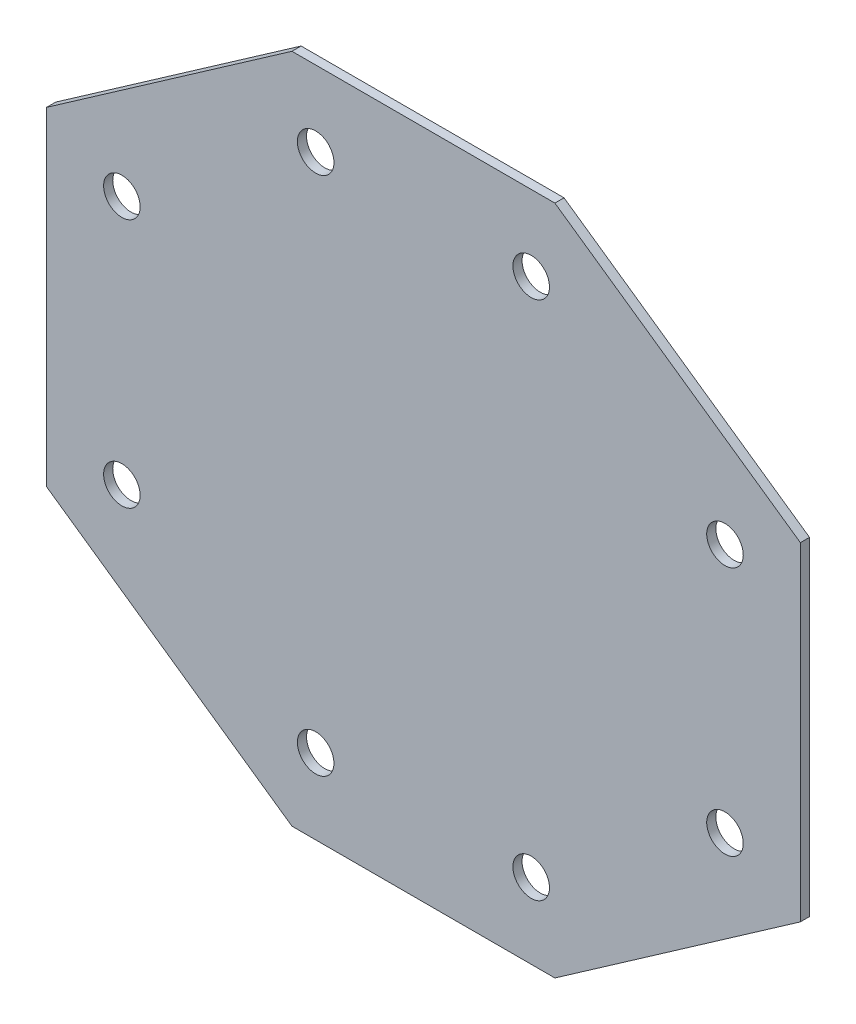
SolidWorks part; units mm, degrees
ref_plane "Front Plane" through (0, 0, 0) normal (1, 0, 0) x (0, 1, 0)
ref_plane "Top Plane" through (0, 0, 0) normal (0, 0, 1) x (0, 1, 0)
ref_plane "Right Plane" through (0, 0, 0) normal (0, 1, 0) x (-1, 0, 0)
sketch "sk W14x730" plane through (0, 0, 0) normal (0, 0, 1) x (0, 1, 0)
  point P0 (0, -284.734)
  point P1 (-38.989, 0)
  line B0 (-227.203, -284.734) -> (-227.203, -160.02)
  line B1 (-227.203, -160.02) -> (-54.229, -160.02)
  line B2 (-38.989, -144.78) -> (-38.989, 144.78)
  line B3 (-54.229, 160.02) -> (-227.203, 160.02)
  line B4 (-227.203, 160.02) -> (-227.203, 284.734)
  line B5 (-227.203, 284.734) -> (227.203, 284.734)
  line B6 (227.203, 284.734) -> (227.203, 160.02)
  line B7 (227.203, 160.02) -> (54.229, 160.02)
  line B8 (38.989, 144.78) -> (38.989, -144.78)
  line B9 (54.229, -160.02) -> (227.203, -160.02)
  line B10 (227.203, -160.02) -> (227.203, -284.734)
  line B11 (227.203, -284.734) -> (-227.203, -284.734)
  arc B12 (-54.229, -160.02) -> (-38.989, -144.78) centre (-54.229, -144.78) ccw
  arc B13 (-38.989, 144.78) -> (-54.229, 160.02) centre (-54.229, 144.78) ccw
  arc B14 (54.229, 160.02) -> (38.989, 144.78) centre (54.229, 144.78) ccw
  arc B15 (38.989, -144.78) -> (54.229, -160.02) centre (54.229, -144.78) ccw
sketch_block_instance "W14x730-113"
sketch_block "W14x730" parameters "D4"=15.24, "D1"=454.406, "D2"=569.468, "D3"=77.978, "D5"=124.714
sketch_block_instance "W14x730-232"
sketch_block_instance "W14x730-233"
sketch_block_instance "W14x730-234"
sketch_block_instance "W14x730-276"
sketch_block_instance "W14x730-277"
sketch_block_instance "W14x730-278"
sketch_block_instance "W14x730-279"
sketch_block_instance "W14x730-280"
sketch_block_instance "W14x730-281"
sketch_block_instance "W14x730-282"
sketch_block_instance "W14x730-283"
sketch_block_instance "W14x730-284"
sketch_block_instance "W14x730-285"
sketch_block_instance "W14x730-286"
sketch_block_instance "W14x730-287"
sketch_block_instance "W14x730-288"
sketch_block_instance "W14x730-289"
sketch_block_instance "W14x730-321"
sketch_block_instance "W14x730-322"
sketch_block_instance "W14x730-323"
sketch_block_instance "W14x730-324"
sketch_block_instance "W14x730-325"
sketch_block_instance "W14x730-326"
sketch_block_instance "W14x730-327"
sketch_block_instance "W14x730-328"
sketch_block_instance "W14x730-329"
sketch_block_instance "W14x730-330"
sketch_block_instance "W14x730-331"
sketch_block_instance "W14x730-332"
sketch_block_instance "W14x730-333"
sketch_block_instance "W14x730-334"
sketch_block_instance "W14x730-335"
sketch_block_instance "W14x730-336"
sketch_block_instance "W14x730-337"
sketch_block_instance "W14x730-338"
sketch_block_instance "W14x730-339"
sketch_block_instance "W14x730-340"
sketch_block_instance "W14x730-341"
sketch_block_instance "W14x730-365"
sketch_block_instance "W14x730-366"
sketch_block_instance "W14x730-367"
sketch_block_instance "W14x730-368"
sketch_block_instance "W14x730-369"
sketch_block_instance "W14x730-370"
sketch_block_instance "W14x730-371"
sketch_block_instance "W14x730-372"
sketch_block_instance "W14x730-373"
sketch_block_instance "W14x730-374"
sketch_block_instance "W14x730-375"
sketch_block_instance "W14x730-376"
sketch_block_instance "W14x730-377"
sketch_block_instance "W14x730-378"
sketch_block_instance "W14x730-379"
sketch_block_instance "W14x730-380"
sketch_block_instance "W14x730-381"
sketch_block_instance "W14x730-382"
sketch_block_instance "W14x730-383"
sketch_block_instance "W14x730-384"
sketch_block_instance "W14x730-385"
sketch_block_instance "W14x730-386"
sketch_block_instance "W14x730-387"
sketch_block_instance "W14x730-388"
sketch_block_instance "W14x730-389"
sketch_block_instance "W14x730-390"
sketch_block_instance "W14x730-391"
sketch_block_instance "W14x730-410"
sketch_block_instance "W14x730-411"
sketch_block_instance "W14x730-412"
sketch_block_instance "W14x730-413"
sketch_block_instance "W14x730-414"
sketch_block_instance "W14x730-415"
sketch_block_instance "W14x730-416"
sketch_block_instance "W14x730-417"
sketch_block_instance "W14x730-418"
sketch_block_instance "W14x730-419"
sketch_block_instance "W14x730-420"
sketch_block_instance "W14x730-421"
sketch_block_instance "W14x730-422"
sketch_block_instance "W14x730-423"
sketch_block_instance "W14x730-424"
sketch_block_instance "W14x730-425"
sketch_block_instance "W14x730-426"
sketch_block_instance "W14x730-427"
sketch_block_instance "W14x730-428"
sketch_block_instance "W14x730-429"
sketch_block_instance "W14x730-430"
sketch_block_instance "W14x730-431"
sketch_block_instance "W14x730-432"
sketch_block_instance "W14x730-433"
sketch_block_instance "W14x730-434"
sketch_block_instance "W14x730-435"
sketch_block_instance "W14x730-436"
sketch_block_instance "W14x730-437"
sketch_block_instance "W14x730-438"
sketch_block_instance "W14x730-439"
sketch_block_instance "W14x730-440"
sketch_block_instance "W14x730-443"
sketch_block_instance "W14x730-454"
sketch_block_instance "W14x730-455"
sketch_block_instance "W14x730-456"
sketch_block_instance "W14x730-457"
sketch_block_instance "W14x730-458"
sketch_block_instance "W14x730-459"
sketch_block_instance "W14x730-460"
sketch_block_instance "W14x730-461"
sketch_block_instance "W14x730-462"
sketch_block_instance "W14x730-463"
sketch_block_instance "W14x730-464"
sketch_block_instance "W14x730-465"
sketch_block_instance "W14x730-466"
sketch_block_instance "W14x730-467"
sketch_block_instance "W14x730-468"
sketch_block_instance "W14x730-469"
sketch_block_instance "W14x730-470"
sketch_block_instance "W14x730-471"
sketch_block_instance "W14x730-472"
sketch_block_instance "W14x730-473"
sketch_block_instance "W14x730-474"
sketch_block_instance "W14x730-475"
sketch_block_instance "W14x730-476"
sketch_block_instance "W14x730-477"
sketch_block_instance "W14x730-478"
sketch_block_instance "W14x730-479"
sketch_block_instance "W14x730-480"
sketch_block_instance "W14x730-481"
sketch_block_instance "W14x730-482"
sketch_block_instance "W14x730-483"
sketch_block_instance "W14x730-484"
sketch_block_instance "W14x730-485"
sketch_block_instance "W14x730-486"
sketch_block_instance "W14x730-487"
sketch_block_instance "W14x730-488"
sketch_block_instance "W14x730-489"
sketch_block_instance "W14x730-490" parameters "D1"=817.9177, "D2"=1027.7361, "D3"=0.4058, "D4"=24.0009, "D5"=0.4058, "D6"=533.4, "D7"=27.3509, "D8"=8374.3758, "D9"=3499.6788, "D10"=18059.4
sketch "sk 4\" hex nut Pattern" plane through (0, 0, 0) normal (0, 0, 1) x (0, 1, 0)
  line L7 (419.0803, -173.5887) -> (419.0803, 173.5887)
  line L8 (419.0803, 173.5887) -> (173.5887, 419.0803)
  line L9 (173.5887, 419.0803) -> (-173.5887, 419.0803)
  line L10 (-173.5887, 419.0803) -> (-419.0803, 173.5887)
  line L11 (-419.0803, 173.5887) -> (-419.0803, -173.5887)
  line L12 (-419.0803, -173.5887) -> (-173.5887, -419.0803)
  line L13 (-173.5887, -419.0803) -> (173.5887, -419.0803)
  line L14 (173.5887, -419.0803) -> (419.0803, -173.5887)
  line L29 (54.229, -125.02) -> (262.203, -125.02)
  line L30 (262.203, -125.02) -> (262.203, -319.734)
  line L31 (-262.203, -125.02) -> (-54.229, -125.02)
  line L32 (-262.203, -319.734) -> (-262.203, -125.02)
  line L33 (262.203, -319.734) -> (-262.203, -319.734)
  line L34 (54.229, -125.02) -> (262.203, -125.02)
  line L35 (262.203, -125.02) -> (262.203, -319.734)
  line L36 (-262.203, -125.02) -> (-54.229, -125.02)
  line L37 (-262.203, -319.734) -> (-262.203, -125.02)
  line L38 (262.203, -319.734) -> (-262.203, -319.734)
  line L39 (-419.0803, 173.5887) -> (419.0803, -173.5887)
  line L40 (419.0803, 173.5887) -> (-419.0803, -173.5887)
  line L42 (-466.3243, 523.8553) -> (466.3243, 523.8553)
  line L43 (-466.3243, 523.8553) -> (-466.3243, -523.8553)
  line L44 (262.203, 125.02) -> (54.229, 125.02)
  line L45 (262.203, 319.734) -> (262.203, 125.02)
  line L46 (-262.203, 319.734) -> (262.203, 319.734)
  line L47 (-262.203, 125.02) -> (-262.203, 319.734)
  line L48 (-54.229, 125.02) -> (-262.203, 125.02)
  line L49 (262.203, 125.02) -> (54.229, 125.02)
  line L50 (262.203, 319.734) -> (262.203, 125.02)
  line L51 (-262.203, 319.734) -> (262.203, 319.734)
  line L52 (-262.203, 125.02) -> (-262.203, 319.734)
  line L53 (-54.229, 125.02) -> (-262.203, 125.02)
  line L54 (-466.3243, -523.8553) -> (466.3243, -523.8553)
  line L55 (466.3243, 523.8553) -> (466.3243, -523.8553)
  circle A0 centre (0, 0) radius 419.0803 construction
  line B0 (-128.6781, -496.8678) -> (-83.7675, -419.0803)
  circle B1 centre (-173.5887, -419.0803) radius 77.7875 construction
  circle B2 centre (-173.5887, -419.0803) radius 50.8
  circle B3 centre (-173.5887, -419.0803) radius 89.8213
  circle B4 centre (-173.5887, -419.0803) radius 99.3463
  line B5 (-83.7675, 419.0803) -> (-128.6781, 496.8678)
  line B6 (-128.6781, 496.8678) -> (-218.4994, 496.8678)
  line B7 (-218.4994, 496.8678) -> (-263.41, 419.0803)
  line B8 (-263.41, 419.0803) -> (-218.4994, 341.2928)
  line B9 (-218.4994, 341.2928) -> (-128.6781, 341.2928)
  circle B10 centre (-173.5887, 419.0803) radius 77.7875 construction
  circle B11 centre (-173.5887, 419.0803) radius 50.8
  circle B12 centre (-173.5887, 419.0803) radius 89.8213
  circle B13 centre (-173.5887, 419.0803) radius 99.3463
  line B14 (263.41, 419.0803) -> (218.4994, 496.8678)
  line B15 (218.4994, 496.8678) -> (128.6781, 496.8678)
  line B16 (128.6781, 496.8678) -> (83.7675, 419.0803)
  line B17 (128.6781, 341.2928) -> (218.4994, 341.2928)
  line B18 (218.4994, 341.2928) -> (263.41, 419.0803)
  circle B19 centre (173.5887, 419.0803) radius 50.8
  circle B20 centre (173.5887, 419.0803) radius 89.8213
  circle B21 centre (173.5887, 419.0803) radius 99.3463
  line B22 (263.41, -419.0803) -> (218.4994, -341.2928)
  line B23 (218.4994, -341.2928) -> (128.6781, -341.2928)
  line B24 (83.7675, -419.0803) -> (128.6781, -496.8678)
  line B25 (128.6781, -496.8678) -> (218.4994, -496.8678)
  line B26 (218.4994, -496.8678) -> (263.41, -419.0803)
  circle B27 centre (173.5887, -419.0803) radius 77.7875 construction
  circle B28 centre (173.5887, -419.0803) radius 50.8
  circle B29 centre (173.5887, -419.0803) radius 89.8213
  circle B30 centre (173.5887, -419.0803) radius 99.3463
  line B31 (-271.728, 149.7586) -> (-316.6386, 227.5461)
  line B32 (-316.6386, 227.5461) -> (-406.4599, 227.5461)
  line B33 (-406.4599, 227.5461) -> (-451.3705, 149.7586)
  line B34 (-451.3705, 149.7586) -> (-406.4599, 71.9711)
  line B35 (-406.4599, 71.9711) -> (-316.6386, 71.9711)
  circle B36 centre (-361.5493, 149.7586) radius 77.7875 construction
  circle B37 centre (-361.5493, 149.7586) radius 50.8
  circle B38 centre (-361.5493, 149.7586) radius 89.8213
  circle B39 centre (-361.5493, 149.7586) radius 99.3463
  line B40 (-271.728, -149.7586) -> (-316.6386, -71.9711)
  line B41 (-316.6386, -71.9711) -> (-406.4599, -71.9711)
  line B42 (-406.4599, -71.9711) -> (-451.3705, -149.7586)
  line B43 (-451.3705, -149.7586) -> (-406.4599, -227.5461)
  line B44 (-406.4599, -227.5461) -> (-316.6386, -227.5461)
  line B45 (-316.6386, -227.5461) -> (-271.728, -149.7586)
  circle B46 centre (-361.5493, -149.7586) radius 77.7875 construction
  circle B47 centre (-361.5493, -149.7586) radius 50.8
  circle B48 centre (-361.5493, -149.7586) radius 89.8213
  circle B49 centre (-361.5493, -149.7586) radius 99.3463
  line B50 (451.3705, 149.7586) -> (406.4599, 227.5461)
  line B51 (406.4599, 227.5461) -> (316.6386, 227.5461)
  line B52 (316.6386, 227.5461) -> (271.728, 149.7586)
  line B53 (316.6386, 71.9711) -> (406.4599, 71.9711)
  circle B54 centre (361.5493, 149.7586) radius 77.7875 construction
  circle B55 centre (361.5493, 149.7586) radius 50.8
  circle B56 centre (361.5493, 149.7586) radius 89.8213
  circle B57 centre (361.5493, 149.7586) radius 99.3463
  line B58 (316.6386, -71.9711) -> (271.728, -149.7586)
  line B59 (406.4599, -227.5461) -> (451.3705, -149.7586)
  circle B60 centre (361.5493, -149.7586) radius 77.7875 construction
  circle B61 centre (361.5493, -149.7586) radius 50.8
  circle B62 centre (361.5493, -149.7586) radius 89.8213
  circle B63 centre (361.5493, -149.7586) radius 99.3463
sketch_block_instance "4\" hex nut-1"
sketch_block "4\" hex nut" parameters "D1"=155.575, "D2"=101.6, "D3"=9.525
sketch_block_instance "4\" hex nut-2"
sketch_block_instance "4\" hex nut-3"
sketch_block_instance "4\" hex nut-4"
sketch_block_instance "4\" hex nut-5"
sketch_block_instance "4\" hex nut-6"
sketch_block_instance "4\" hex nut-7"
sketch_block_instance "4\" hex nut-8" parameters "D1"=129.9071, "D2"=77.383, "D3"=138.8929, "D4"=187.7059, "D5"=195.0068, "D6"=231.3326
sketch "Sketch3" plane through (0, 0, 0) normal (0, 0, 1) x (0, 1, 0)
  line L0 (-466.3243, 523.8553) -> (466.3243, 523.8553) construction
  line L1 (466.3243, 523.8553) -> (466.3243, -523.8553) construction
  line L2 (-466.3243, -523.8553) -> (466.3243, -523.8553) construction
  line L3 (-466.3243, 523.8553) -> (-466.3243, -523.8553) construction
  line L4 (228.2342, 523.8553) -> (466.3243, 182.7049)
  line L5 (466.3243, 182.7049) -> (466.3243, -182.7049)
  line L6 (466.3243, -182.7049) -> (228.2342, -523.8553)
  line L7 (228.2342, -523.8553) -> (-228.2342, -523.8553)
  line L8 (-228.2342, -523.8553) -> (-466.3243, -182.7049)
  line L9 (-466.3243, -182.7049) -> (-466.3243, 182.7049)
  line L10 (-466.3243, 182.7049) -> (-228.2342, 523.8553)
  line L11 (-228.2342, 523.8553) -> (228.2342, 523.8553)
  line L93 (-54.229, 156.845) -> (-230.378, 156.845)
  line L94 (-230.378, 156.845) -> (-230.378, 287.909)
  line L95 (230.378, 156.845) -> (54.229, 156.845)
  line L96 (230.378, 287.909) -> (230.378, 156.845)
  line L97 (-230.378, 287.909) -> (230.378, 287.909)
  line L98 (-54.229, 156.845) -> (-230.378, 156.845) construction
  line L99 (-230.378, 156.845) -> (-230.378, 287.909) construction
  line L100 (230.378, 156.845) -> (54.229, 156.845) construction
  line L101 (230.378, 287.909) -> (230.378, 156.845) construction
  line L102 (-230.378, 287.909) -> (230.378, 287.909) construction
  line L118 (54.229, -156.845) -> (230.378, -156.845)
  line L119 (230.378, -156.845) -> (230.378, -287.909)
  line L120 (230.378, -287.909) -> (-230.378, -287.909)
  line L121 (-230.378, -287.909) -> (-230.378, -156.845)
  line L122 (-230.378, -156.845) -> (-54.229, -156.845)
  line L123 (54.229, -156.845) -> (230.378, -156.845) construction
  line L124 (230.378, -156.845) -> (230.378, -287.909) construction
  line L125 (230.378, -287.909) -> (-230.378, -287.909) construction
  line L126 (-230.378, -287.909) -> (-230.378, -156.845) construction
  line L127 (-230.378, -156.845) -> (-54.229, -156.845) construction
  line L130 (42.164, 144.78) -> (42.164, -144.78)
  line L131 (42.164, 144.78) -> (42.164, -144.78) construction
  line L132 (-54.229, 156.845) -> (-42.164, 144.78) construction
  line L133 (-42.164, -144.78) -> (-42.164, 144.78)
  line L134 (-42.164, -144.78) -> (-42.164, 144.78) construction
  line L135 (42.164, 144.78) -> (54.229, 156.845) construction
  line L136 (42.164, -144.78) -> (54.229, -156.845) construction
  line L137 (-54.229, -156.845) -> (-42.164, -144.78) construction
  circle A0 centre (173.5887, 419.0803) radius 104.775 construction
  circle A1 centre (-173.5887, 419.0803) radius 104.775 construction
  circle A2 centre (-361.5493, 149.7586) radius 104.775 construction
  circle A3 centre (-361.5493, -149.7586) radius 104.775 construction
  circle A4 centre (-173.5887, -419.0803) radius 104.775 construction
  circle A5 centre (173.5887, -419.0803) radius 104.775 construction
  circle A6 centre (361.5493, -149.7586) radius 104.775 construction
  circle A7 centre (361.5493, 149.7586) radius 104.775 construction
  dimension "D1" = 3.175
  dimension "D2" = 3.175
  dimension "D3" = 3.175
  dimension "D4" = 3.175
extrude "Main Plate" add sketch "Sketch3" along normal blind 12.7
sketch "Sketch5" plane through (0, 0, 0) normal (0, 0, 1) x (0, 1, 0)
  circle A0 centre (-173.5887, 419.0803) radius 25.4
  circle A1 centre (173.5887, 419.0803) radius 25.4
  circle A2 centre (361.5493, 149.7586) radius 25.4
  circle A3 centre (361.5493, -149.7586) radius 25.4
  circle A4 centre (173.5887, -419.0803) radius 25.4
  circle A5 centre (-173.5887, -419.0803) radius 25.4
  circle A6 centre (-361.5493, -149.7586) radius 25.4
  circle A7 centre (-361.5493, 149.7586) radius 25.4
  dimension "D1" = 50.8
  dimension "D2" = 50.8
  dimension "D3" = 50.8
  dimension "D4" = 50.8
  dimension "D5" = 50.8
  dimension "D6" = 50.8
  dimension "D7" = 50.8
  dimension "D8" = 50.8
extrude "Cut-Extrude1" cut sketch "Sketch5" against normal through all both and the other way through all
